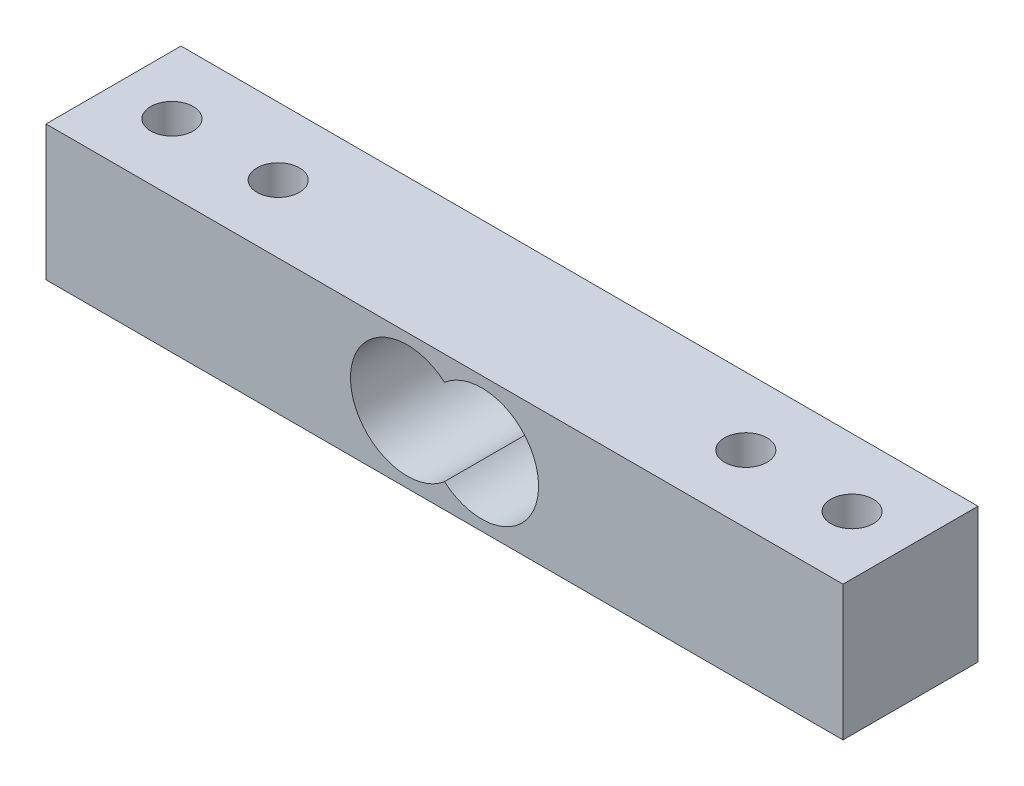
SolidWorks part; units mm, degrees
ref_plane "Front Plane" through (0, 0, 0) normal (0, 0, 1) x (1, 0, 0)
ref_plane "Top Plane" through (0, 0, 0) normal (0, 1, 0) x (1, 0, 0)
ref_plane "Right Plane" through (0, 0, 0) normal (1, 0, 0) x (0, 0, -1)
sketch "Sketch1" plane through (0, 0, 0) normal (0, 1, 0) x (1, 0, 0)
  line L0 (0, -6.985) -> (0, 6.985) construction
  line L1 (37.5, -6.35) -> (-37.5, -6.35)
  line L2 (37.5, -6.35) -> (37.5, 6.35)
  line L3 (37.5, 6.35) -> (-37.5, 6.35)
  line L4 (-37.5, -6.35) -> (-37.5, 6.35)
  line L5 (37.5, -6.35) -> (-37.5, 6.35) construction
  line L6 (37.5, 6.35) -> (-37.5, -6.35) construction
  circle A0 centre (-22, 0) radius 2
  circle A1 centre (-32, 0) radius 2
  circle A2 centre (22, 0) radius 2
  circle A3 centre (32, 0) radius 2
  point P0 (0, 0)
  dimension "D5" = 4
  dimension "D1" = 75
  dimension "D2" = 12.7
  dimension "D3" = 22
  dimension "D4" = 32
extrude "Boss-Extrude1" add sketch "Sketch1" along normal blind 12.7 contours L3 L4 L1 L2
sketch "Sketch2" plane through (0, 0, 6.35) normal (0, 0, 1) x (1, 0, 0)
  line L0 (-37.5, 12.7) -> (-37.5, 0) construction
  line L2 (-37.5, 0) -> (37.5, 0) construction
  arc A0 (0, 10.3963) -> (0, 2.3037) centre (-3.5, 6.35) ccw
  arc A1 (0, 2.3037) -> (0, 10.3963) centre (3.5, 6.35) ccw
  point P0 (-37.5, 6.35)
  point P8 (-3.5, 1)
  dimension "D2" = 1
  dimension "D1" = 3.5
  dimension "D3" = 7
extrude "Cut-Extrude1" cut sketch "Sketch2" against normal blind 12.7
